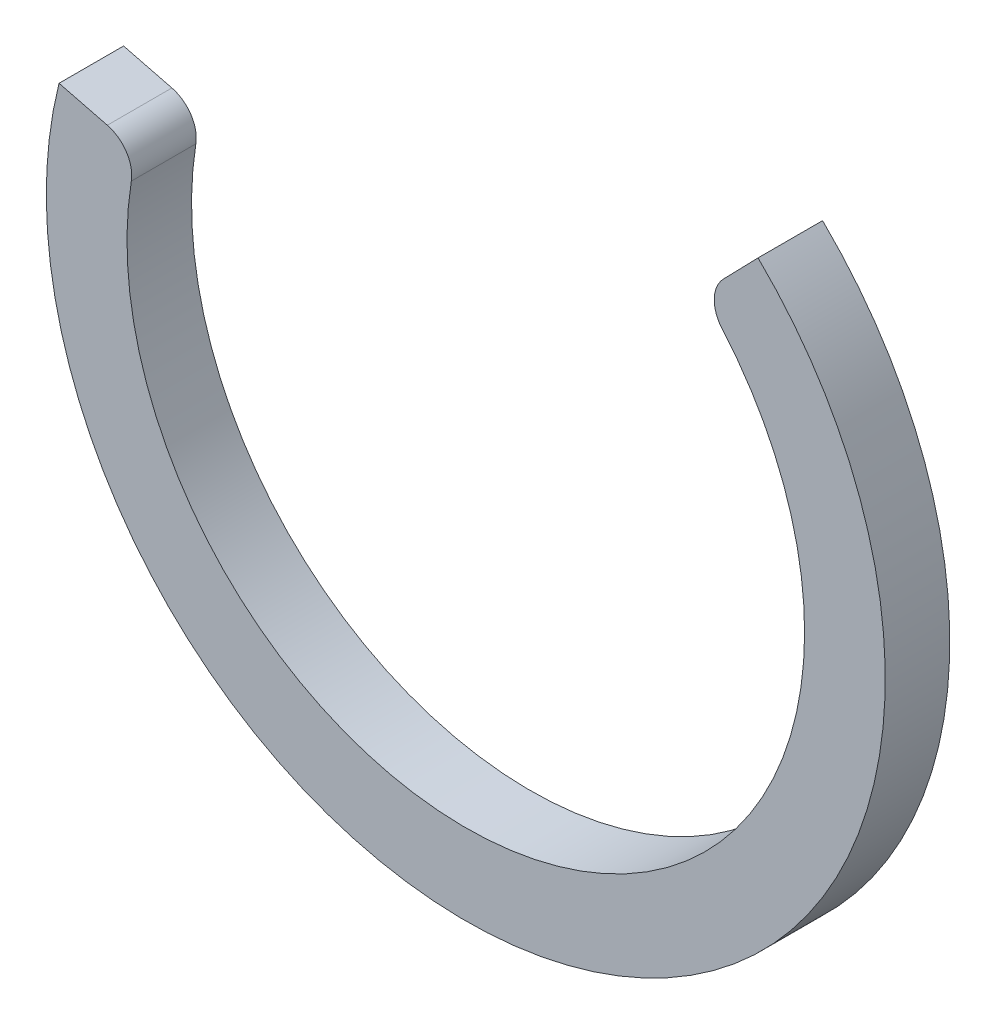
SolidWorks part; units mm, degrees
ref_plane "前视基准面" through (0, 0, 0) normal (0, 0, 1) x (1, 0, 0)
ref_plane "上视基准面" through (0, 0, 0) normal (0, 1, 0) x (1, 0, 0)
ref_plane "右视基准面" through (0, 0, 0) normal (1, 0, 0) x (0, 0, -1)
sketch "草图1" plane through (0, 0, 0) normal (0, 0, 1) x (1, 0, 0)
  circle A0 centre (0, 0) radius 65
  dimension "D1" = 130
extrude "凸台-拉伸1" add sketch "草图1" along normal blind 10
sketch "草图2" plane through (0, 0, 10) normal (0, 0, 1) x (1, 0, 0)
  circle A0 centre (0, 0) radius 52.5
  dimension "D1" = 105
extrude "切除-拉伸1" cut sketch "草图2" against normal blind 10
sketch "草图3" plane through (0, 0, 0) normal (0, 0, -1) x (-1, 0, 0)
  line L0 (-45.2858, 46.6283) -> (63.0242, 15.9045) construction
  line L1 (63.0242, 15.9045) -> (0, 0) construction
  line L2 (0, 0) -> (-45.2858, 46.6283) construction
  line L3 (-45.2858, 46.6283) -> (0, 0)
  line L4 (0, 0) -> (63.0242, 15.9045)
  arc A0 (-45.2858, 46.6283) -> (63.0242, 15.9045) centre (0, 0) cw
  circle A1 centre (0, 0) radius 65 construction
  dimension "D1" = 120
extrude "切除-拉伸2" cut sketch "草图3" against normal blind 10
ref_plane "基准面1" through (-50.9041, 12.846, 0) normal (0, 0, 1) x (1, 0, 0)
fillet "圆角1" radius 5 1 edges at (-50.9041, 12.846, 5)
fillet "圆角2" radius 5 1 edges at (36.577, 37.6613, 5)
